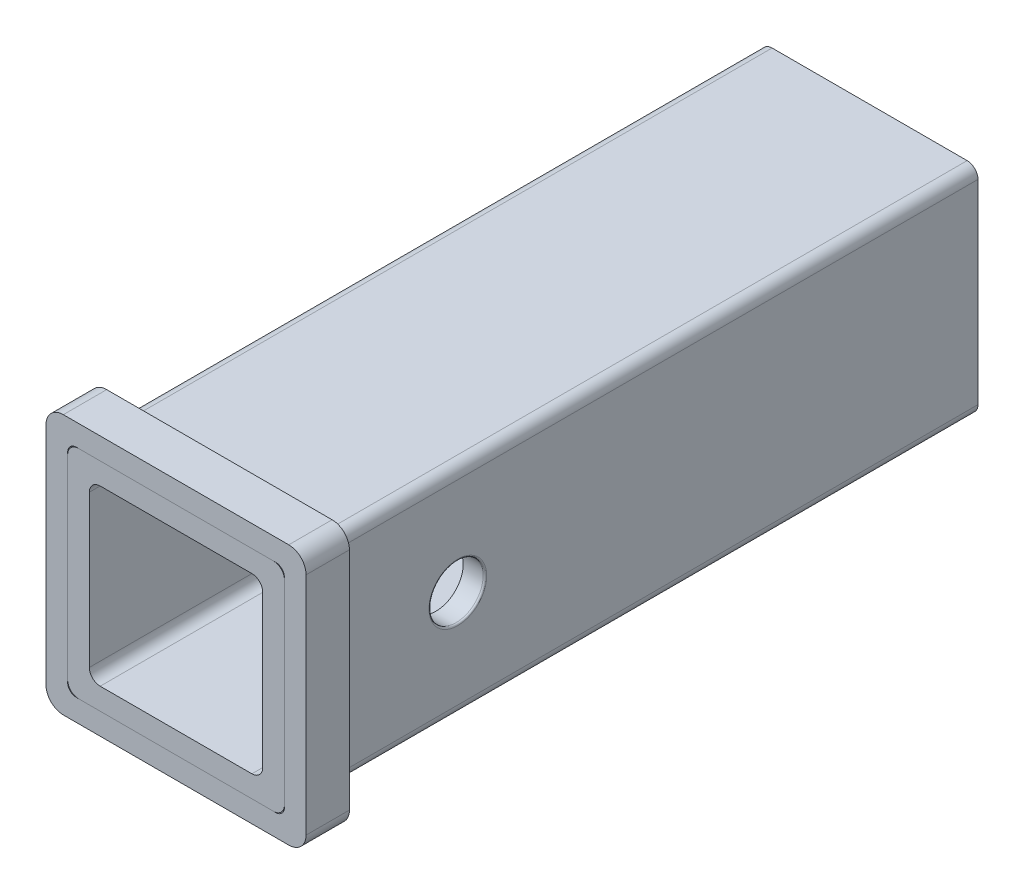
SolidWorks part; units mm, degrees
ref_plane "Front" through (0, 0, 0) normal (0, 0, 1) x (1, 0, 0)
ref_plane "Top" through (0, 0, 0) normal (0, 1, 0) x (1, 0, 0)
ref_plane "Right" through (0, 0, 0) normal (1, 0, 0) x (0, 0, -1)
sketch "Sketch1" plane through (0, 0, 0) normal (1, 0, 0) x (0, 0, -1)
  line L0 (0, 0) -> (203.2, 0) construction
  line L1 (0, 38.1) -> (0, -38.1) construction
  line L2 (203.2, 31.75) -> (203.2, -31.75) construction
  line L3 (0, 38.1) -> (12.7, 38.1) construction
  circle A0 centre (50.8, 0) radius 7.9375 construction
  point P7 (50.8, 0)
  dimension "D5" = 15.875
  dimension "D1" = 203.2
  dimension "D2" = 76.2
  dimension "D3" = 63.5
  dimension "D4" = 152.4
  dimension "D6" = 12.7
sketch "Sketch2" plane through (0, 0, 0) normal (0, 0, 1) x (1, 0, 0)
  line L1 (-31.75, 31.75) -> (31.75, 31.75) construction
  line L2 (-31.75, 31.75) -> (-31.75, -31.75) construction
  line L3 (-31.75, -31.75) -> (31.75, -31.75) construction
  line L4 (31.75, 31.75) -> (31.75, -31.75) construction
  line L5 (-31.75, 31.75) -> (31.75, -31.75) construction
  line L6 (-31.75, -31.75) -> (31.75, 31.75) construction
  line L7 (-25.4, 25.4) -> (25.4, 25.4) construction
  line L8 (-25.4, 25.4) -> (-25.4, -25.4) construction
  line L9 (-25.4, -25.4) -> (25.4, -25.4) construction
  line L10 (25.4, 25.4) -> (25.4, -25.4) construction
  line L11 (-25.4, 25.4) -> (25.4, -25.4) construction
  line L12 (-25.4, -25.4) -> (25.4, 25.4) construction
  point P0 (0, 0)
  point P6 (0, 0)
  point P12 (0, -25.4)
  dimension "D1" = 50.8
sketch "Sketch3" plane through (0, 0, 0) normal (0, 0, 1) x (1, 0, 0)
  line L0 (-31.75, 31.75) -> (31.75, 31.75) construction
  line L1 (-31.75, 31.75) -> (31.75, 31.75)
  line L2 (-25.4, 25.4) -> (25.4, 25.4) construction
  line L3 (-31.75, 31.75) -> (-31.75, -31.75) construction
  line L4 (-25.4, 25.4) -> (-25.4, -25.4) construction
  line L5 (-25.4, -25.4) -> (25.4, -25.4) construction
  line L6 (-31.75, -31.75) -> (31.75, -31.75) construction
  line L7 (25.4, 25.4) -> (25.4, -25.4) construction
  line L8 (31.75, 31.75) -> (31.75, -31.75) construction
  line L9 (-25.4, 25.4) -> (25.4, 25.4)
  line L10 (-31.75, 31.75) -> (-31.75, -31.75)
  line L11 (-25.4, 25.4) -> (-25.4, -25.4)
  line L12 (-25.4, -25.4) -> (25.4, -25.4)
  line L13 (-31.75, -31.75) -> (31.75, -31.75)
  line L14 (25.4, 25.4) -> (25.4, -25.4)
  line L15 (31.75, 31.75) -> (31.75, -31.75)
extrude "Boss-Extrude1" add sketch "Sketch3" against normal up to vertex (203.2 mm away)
fillet "Fillet1" radius 3.175 8 edges at (25.4, -25.4, -101.6) (-25.4, -25.4, -101.6) (-31.75, -31.75, -101.6) (31.75, -31.75, -101.6) (25.4, 25.4, -101.6) (-25.4, 25.4, -101.6) (-31.75, 31.75, -101.6) (31.75, 31.75, -101.6)
sketch "Sketch4" plane through (0, 0, 0) normal (0, 0, 1) x (1, 0, 0)
  line L0 (-31.75, 31.75) -> (31.75, 31.75) construction
  line L1 (-38.1, 38.1) -> (38.1, 38.1)
  line L2 (-38.1, 38.1) -> (-38.1, -38.1)
  line L3 (-38.1, -38.1) -> (38.1, -38.1)
  line L4 (38.1, 38.1) -> (38.1, -38.1)
  line L5 (-38.1, 38.1) -> (38.1, -38.1) construction
  line L6 (-38.1, -38.1) -> (38.1, 38.1) construction
  line L7 (-31.75, 31.75) -> (-31.75, -31.75) construction
  line L8 (-31.75, -31.75) -> (31.75, -31.75) construction
  line L9 (31.75, 31.75) -> (31.75, -31.75) construction
  line L10 (-31.75, 31.75) -> (31.75, 31.75)
  line L11 (-31.75, 31.75) -> (-31.75, -31.75)
  line L12 (-31.75, -31.75) -> (31.75, -31.75)
  line L13 (31.75, 31.75) -> (31.75, -31.75)
  point P0 (0, 0)
extrude "Boss-Extrude2" add sketch "Sketch4" against normal up to vertex (12.7 mm away) separate body
fillet "Fillet2" radius 5.08 4 edges at (-38.1, -38.1, -6.35) (-38.1, 38.1, -6.35) (38.1, -38.1, -6.35) (38.1, 38.1, -6.35)
fillet "Fillet3" radius 2.54 4 edges at (31.75, -31.75, -6.35) (-31.75, -31.75, -6.35) (31.75, 31.75, -6.35) (-31.75, 31.75, -6.35)
sketch "Sketch5" plane through (0, 0, 0) normal (1, 0, 0) x (0, 0, -1)
  circle A0 centre (50.8, 0) radius 7.9375 construction
  circle A1 centre (50.8, 0) radius 7.9375
extrude "Cut-Extrude1" cut sketch "Sketch5" against normal through all both and the other way through all
fillet "Fillet4" radius 0.508 2 edges at (-31.75, 0, -42.8625) (31.75, 0, -58.7375)
